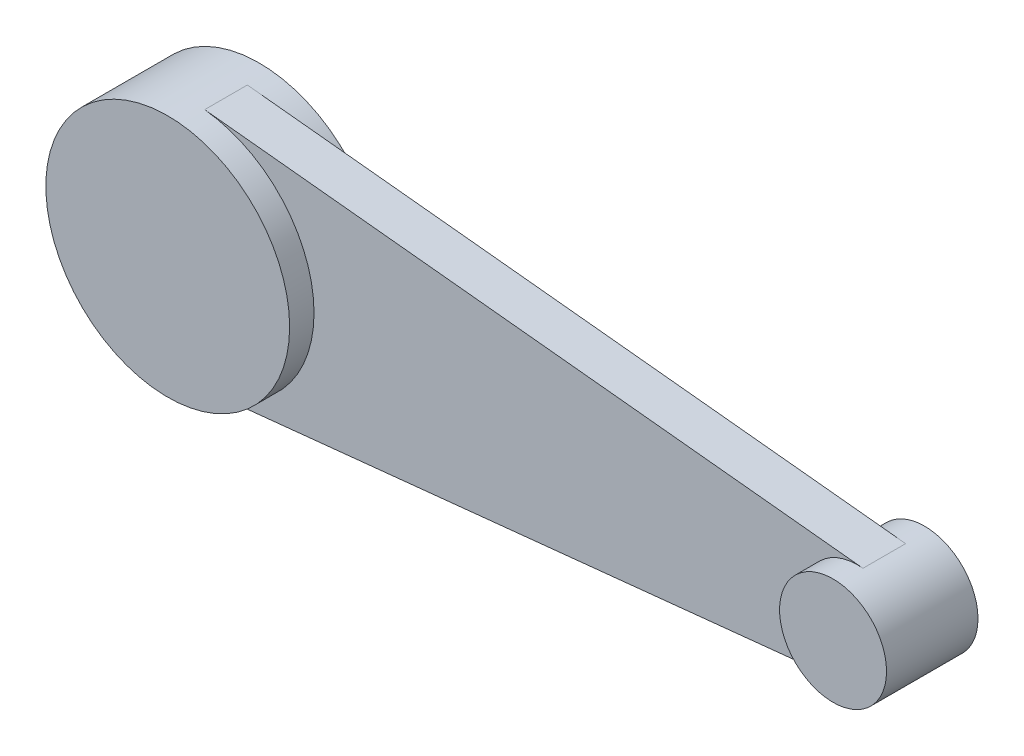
SolidWorks part; units mm, degrees
ref_plane "Front Plane" through (0, 0, 0) normal (0, 0, 1) x (1, 0, 0)
ref_plane "Top Plane" through (0, 0, 0) normal (0, 1, 0) x (1, 0, 0)
ref_plane "Right Plane" through (0, 0, 0) normal (1, 0, 0) x (0, 0, -1)
sketch "Sketch1" plane through (0, 0, 0) normal (0, 0, 1) x (1, 0, 0)
  circle A0 centre (-81.8722, 0) radius 25.3908
  circle A1 centre (56.7003, 0) radius 11.139
extrude "Extrude1" add sketch "Sketch1" along normal mid plane 19.05
sketch "Sketch2" plane through (0, 0, 0) normal (0, 0, 1) x (1, 0, 0)
  line L0 (-79.2608, 25.2562) -> (57.8459, 11.0799)
  line L1 (-79.2608, -25.2562) -> (57.8459, -11.0799)
  circle A2 centre (-81.8722, 0) radius 25.3908 construction
  circle A3 centre (56.7003, 0) radius 11.139 construction
  arc A4 (57.8459, 11.0799) -> (57.8459, -11.0799) centre (56.7003, 0) ccw
  arc A5 (-79.2608, -25.2562) -> (-79.2608, 25.2562) centre (-81.8722, 0) ccw
extrude "Extrude2" add sketch "Sketch2" along normal mid plane 8.89
